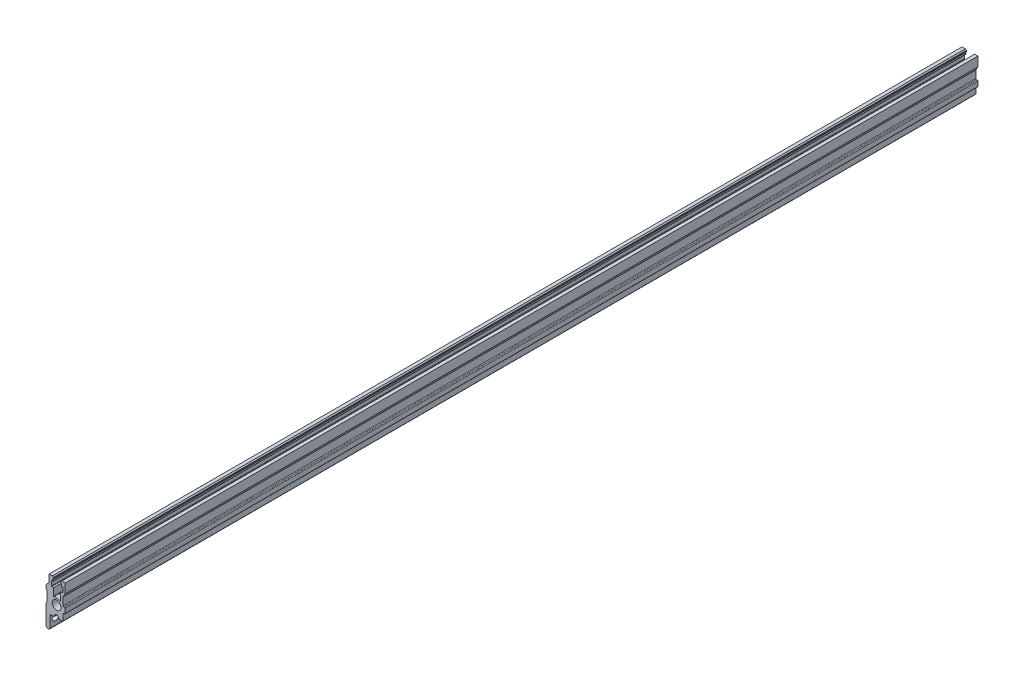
SolidWorks part; units mm, degrees
ref_plane "前视基准面" through (0, 0, 0) normal (0, 0, 1) x (1, 0, 0)
ref_plane "上视基准面" through (0, 0, 0) normal (0, 1, 0) x (1, 0, 0)
ref_plane "右视基准面" through (0, 0, 0) normal (1, 0, 0) x (0, 0, -1)
sketch "草图1" plane through (0, 0, 0) normal (0, 0, 1) x (1, 0, 0)
  line L0 (-2.3509, 8.9116) -> (-2.3509, 6.6116)
  line L1 (-2.3509, 8.9116) -> (-1.4509, 8.9116)
  line L2 (-1.4509, 8.9116) -> (-1.4509, 11.7916)
  line L3 (-1.4509, 11.7916) -> (-4.1259, 11.7916)
  line L4 (-4.1259, 11.7916) -> (-4.1259, 10.0616)
  line L5 (-4.1259, 10.0616) -> (-3.5009, 9.8916)
  line L6 (-3.5009, 9.8916) -> (-3.5009, 8.5216)
  line L7 (-3.5009, 8.5216) -> (-5.0009, 8.5216)
  line L8 (-5.0009, 8.5216) -> (-5.0009, 4.4416)
  line L9 (-5.0009, 4.4416) -> (-4.5507, 3.9414)
  line L10 (-4.5507, 3.9414) -> (-4.551, -1.0586)
  line L11 (-4.551, -1.0586) -> (-5.0009, -1.5584)
  line L12 (-5.0009, -1.5584) -> (-5.0009, -10.75)
  line L13 (-3.0009, -10.75) -> (-3.0009, -5.75)
  line L14 (2.9991, -5.05) -> (2.9991, -2.0584)
  line L15 (3.2991, -1.7584) -> (3.6991, -1.7584)
  line L16 (3.9991, -2.0584) -> (3.9991, -3.4584) construction
  line L17 (4.2991, -3.7584) -> (4.6991, -3.7584) construction
  line L18 (4.9991, -3.4584) -> (4.9991, 2.6416) construction
  line L19 (4.6991, 2.9416) -> (4.2991, 2.9416) construction
  line L20 (3.9991, 2.6416) -> (3.9991, 1.2416) construction
  line L21 (3.6991, 0.9416) -> (3.2991, 0.9416)
  line L22 (2.9991, 1.2416) -> (2.9991, 4.8054)
  line L23 (2.9991, 4.8054) -> (3.9991, 6.5374)
  line L24 (3.9991, 6.5374) -> (3.9991, 9.5216)
  line L25 (3.9991, 9.5216) -> (3.1241, 9.5216)
  line L26 (3.1241, 10.7916) -> (3.1241, 11.7916)
  line L27 (3.1241, 11.7916) -> (1.9491, 11.7916)
  line L28 (1.9491, 11.7916) -> (1.9491, 8.9116)
  line L29 (1.9491, 8.9116) -> (2.8491, 8.9116)
  line L30 (2.8491, 6.6116) -> (2.8491, 8.9116)
  line L31 (2.8491, 6.6116) -> (1.9491, 6.6116)
  line L32 (1.9491, 6.6116) -> (1.9491, 2.6797)
  line L33 (-1.4509, 2.9454) -> (-1.4509, 6.6116)
  line L34 (-1.4509, 6.6116) -> (-2.3509, 6.6116)
  line L35 (0, 0) -> (0, -5) construction
  line L36 (-1.05, -5) -> (-1.05, -5.15)
  line L37 (1.05, -5) -> (1.05, -5.15)
  line L38 (1.15, -5.25) -> (2.7991, -5.25)
  line L39 (-2.5009, -5.25) -> (-1.15, -5.25)
  line L40 (-1.4509, 10.3516) -> (1.9491, 10.3516) construction
  line L41 (-3.0009, -10.75) -> (-5.0009, -10.75) construction
  line L42 (0.2491, 10.3516) -> (0.2491, 6.8507) construction
  line L44 (3.9991, 0.6416) -> (3.9991, -1.4584)
  arc A0 (-5.0009, -10.75) -> (-3.0009, -10.75) centre (-4.0009, -10.75) ccw
  arc A1 (3.2991, -1.7584) -> (2.9991, -2.0584) centre (3.2991, -2.0584) ccw
  arc A2 (3.9991, -2.0584) -> (3.6991, -1.7584) centre (3.6991, -2.0584) ccw construction
  arc A3 (3.9991, -3.4584) -> (4.2991, -3.7584) centre (4.2991, -3.4584) ccw construction
  arc A4 (4.6991, -3.7584) -> (4.9991, -3.4584) centre (4.6991, -3.4584) ccw construction
  arc A5 (4.9991, 2.6416) -> (4.6991, 2.9416) centre (4.6991, 2.6416) ccw construction
  arc A6 (4.2991, 2.9416) -> (3.9991, 2.6416) centre (4.2991, 2.6416) ccw construction
  arc A7 (3.6991, 0.9416) -> (3.9991, 1.2416) centre (3.6991, 1.2416) ccw construction
  arc A8 (2.9991, 1.2416) -> (3.2991, 0.9416) centre (3.2991, 1.2416) ccw
  arc A9 (3.1241, 10.7916) -> (3.1241, 9.5216) centre (3.1841, 10.1566) ccw
  circle A10 centre (0, 0) radius 1.6
  arc A11 (1.6398, 2.5122) -> (-1.1727, 2.7613) centre (0, 0) ccw
  arc A12 (1.6398, 2.5122) -> (1.9491, 2.6797) centre (1.7491, 2.6797) ccw
  arc A13 (-1.4509, 2.9454) -> (-1.1727, 2.7613) centre (-1.2509, 2.9454) ccw
  arc A14 (1.05, -5) -> (-1.05, -5) centre (0, -5) ccw
  arc A15 (1.15, -5.25) -> (1.05, -5.15) centre (1.15, -5.15) cw
  arc A16 (-1.05, -5.15) -> (-1.15, -5.25) centre (-1.15, -5.15) cw
  arc A17 (3.6991, 0.9416) -> (3.9991, 0.6416) centre (3.6991, 0.6416) cw
  arc A18 (3.9991, -1.4584) -> (3.6991, -1.7584) centre (3.6991, -1.4584) cw
  arc A19 (2.7991, -5.25) -> (2.9991, -5.05) centre (2.7991, -5.05) ccw
  arc A20 (-3.0009, -5.75) -> (-2.5009, -5.25) centre (-2.5009, -5.75) cw
  point P72 (1.05, -5.25)
  dimension "D1" = 2.1
  dimension "D3" = 5
  dimension "D4" = 0.1
  dimension "D6" = 0.3
  dimension "D2" = 10.75
  dimension "D5" = 5.2
extrude "凸台-拉伸1" add sketch "草图1" along normal mid plane 431.8
sketch "草图9" plane through (0, 0, -215.9) normal (0, 0, -1) x (-1, 0, 0)
  line L0 (2.3509, 8.9116) -> (1.4509, 8.9116) construction
  line L1 (2.4509, 8.9116) -> (-2.9491, 8.9116)
  line L2 (2.4509, 8.9116) -> (2.4509, 6.4116)
  line L3 (2.4509, 6.4116) -> (-2.9491, 6.4116)
  line L4 (-2.9491, 8.9116) -> (-2.9491, 6.4116)
  line L5 (2.3509, 6.6116) -> (2.3509, 8.9116) construction
  line L6 (-2.8491, 8.9116) -> (-2.8491, 6.6116) construction
  line L7 (-2.8491, 6.6116) -> (-1.9491, 6.6116) construction
  dimension "D1" = 0.1
  dimension "D2" = 0.1
  dimension "D3" = 0.2
extrude "切除-拉伸7" cut sketch "草图9" against normal through all
fillet "圆角4" radius 0.2 4 edges at (-2.4509, 8.9116, 0) (-2.4509, 6.4116, 0) (2.9491, 8.9116, 0) (2.9491, 6.4116, 0)
sketch "草图2" plane through (0, 0, -215.9) normal (0, 0, -1) x (-1, 0, 0)
  circle A0 centre (0, 0) radius 2.1
  dimension "D1" = 4.2
extrude "切除-拉伸1" cut sketch "草图2" against normal blind 10
sketch "草图3" plane through (0, 0, 215.9) normal (0, 0, 1) x (1, 0, 0)
  circle A0 centre (0, 0) radius 2.1
  dimension "D1" = 4.2
extrude "切除-拉伸2" cut sketch "草图3" against normal blind 10
sketch "草图4" plane through (-5.0009, 0, 0) normal (-1, 0, 0) x (0, 0, 1)
  line L0 (-215.9, -1.5584) -> (-215.9, -10.75) construction
  line L1 (-215.9, -11.75) -> (215.9, -11.75) construction
  circle A0 centre (-213.36, -7.5) radius 1.65
  circle A1 centre (-208.28, -7.5) radius 1.65
  circle A2 centre (-203.2, -7.5) radius 1.65
  circle A3 centre (-198.12, -7.5) radius 1.65
  circle A4 centre (-193.04, -7.5) radius 1.65
  circle A5 centre (-187.96, -7.5) radius 1.65
  circle A6 centre (-182.88, -7.5) radius 1.65
  circle A7 centre (-177.8, -7.5) radius 1.65
  circle A8 centre (-172.72, -7.5) radius 1.65
  circle A9 centre (-167.64, -7.5) radius 1.65
  circle A10 centre (-162.56, -7.5) radius 1.65
  circle A11 centre (-157.48, -7.5) radius 1.65
  circle A12 centre (-152.4, -7.5) radius 1.65
  circle A13 centre (-147.32, -7.5) radius 1.65
  circle A14 centre (-142.24, -7.5) radius 1.65
  circle A15 centre (-137.16, -7.5) radius 1.65
  circle A16 centre (-132.08, -7.5) radius 1.65
  circle A17 centre (-127, -7.5) radius 1.65
  circle A18 centre (-121.92, -7.5) radius 1.65
  circle A19 centre (-116.84, -7.5) radius 1.65
  circle A20 centre (-111.76, -7.5) radius 1.65
  circle A21 centre (-106.68, -7.5) radius 1.65
  circle A22 centre (-101.6, -7.5) radius 1.65
  circle A23 centre (-96.52, -7.5) radius 1.65
  circle A24 centre (-91.44, -7.5) radius 1.65
  circle A25 centre (-86.36, -7.5) radius 1.65
  circle A26 centre (-81.28, -7.5) radius 1.65
  circle A27 centre (-76.2, -7.5) radius 1.65
  circle A28 centre (-71.12, -7.5) radius 1.65
  circle A29 centre (-66.04, -7.5) radius 1.65
  circle A30 centre (-60.96, -7.5) radius 1.65
  circle A31 centre (-55.88, -7.5) radius 1.65
  circle A32 centre (-50.8, -7.5) radius 1.65
  circle A33 centre (-45.72, -7.5) radius 1.65
  circle A34 centre (-40.64, -7.5) radius 1.65
  circle A35 centre (-35.56, -7.5) radius 1.65
  circle A36 centre (-30.48, -7.5) radius 1.65
  circle A37 centre (-25.4, -7.5) radius 1.65
  circle A38 centre (-20.32, -7.5) radius 1.65
  circle A39 centre (-15.24, -7.5) radius 1.65
  circle A40 centre (-10.16, -7.5) radius 1.65
  circle A41 centre (-5.08, -7.5) radius 1.65
  circle A42 centre (0, -7.5) radius 1.65
  circle A43 centre (5.08, -7.5) radius 1.65
  circle A44 centre (10.16, -7.5) radius 1.65
  circle A45 centre (15.24, -7.5) radius 1.65
  circle A46 centre (20.32, -7.5) radius 1.65
  circle A47 centre (25.4, -7.5) radius 1.65
  circle A48 centre (30.48, -7.5) radius 1.65
  circle A49 centre (35.56, -7.5) radius 1.65
  circle A50 centre (40.64, -7.5) radius 1.65
  circle A51 centre (45.72, -7.5) radius 1.65
  circle A52 centre (50.8, -7.5) radius 1.65
  circle A53 centre (55.88, -7.5) radius 1.65
  circle A54 centre (60.96, -7.5) radius 1.65
  circle A55 centre (66.04, -7.5) radius 1.65
  circle A56 centre (71.12, -7.5) radius 1.65
  circle A57 centre (76.2, -7.5) radius 1.65
  circle A58 centre (81.28, -7.5) radius 1.65
  circle A59 centre (86.36, -7.5) radius 1.65
  circle A60 centre (91.44, -7.5) radius 1.65
  circle A61 centre (96.52, -7.5) radius 1.65
  circle A62 centre (101.6, -7.5) radius 1.65
  circle A63 centre (106.68, -7.5) radius 1.65
  circle A64 centre (111.76, -7.5) radius 1.65
  circle A65 centre (116.84, -7.5) radius 1.65
  circle A66 centre (121.92, -7.5) radius 1.65
  circle A67 centre (127, -7.5) radius 1.65
  circle A68 centre (132.08, -7.5) radius 1.65
  circle A69 centre (137.16, -7.5) radius 1.65
  circle A70 centre (142.24, -7.5) radius 1.65
  circle A71 centre (147.32, -7.5) radius 1.65
  circle A72 centre (152.4, -7.5) radius 1.65
  circle A73 centre (157.48, -7.5) radius 1.65
  circle A74 centre (162.56, -7.5) radius 1.65
  circle A75 centre (167.64, -7.5) radius 1.65
  circle A76 centre (172.72, -7.5) radius 1.65
  circle A77 centre (177.8, -7.5) radius 1.65
  circle A78 centre (182.88, -7.5) radius 1.65
  circle A79 centre (187.96, -7.5) radius 1.65
  circle A80 centre (193.04, -7.5) radius 1.65
  circle A81 centre (198.12, -7.5) radius 1.65
  circle A82 centre (203.2, -7.5) radius 1.65
  circle A83 centre (208.28, -7.5) radius 1.65
  circle A84 centre (213.36, -7.5) radius 1.65
  dimension "D1" = 3.3
  dimension "D5" = 5.08
  dimension "D2" = 2.54
  dimension "D3" = 4.25
  dimension "D4" = 85
extrude "切除-拉伸3" cut sketch "草图4" against normal blind 12
sketch "草图5" plane through (0, 0, 215.9) normal (0, 0, 1) x (1, 0, 0)
  line L0 (1.9491, 8.9116) -> (2.7491, 8.9116) construction
  line L1 (1.9491, 8.9116) -> (3.9991, 8.9116)
  line L2 (1.9491, 8.9116) -> (1.9491, 11.7916)
  line L3 (1.9491, 11.7916) -> (3.9991, 11.7916)
  line L4 (3.9991, 8.9116) -> (3.9991, 11.7916)
  line L5 (3.1241, 11.7916) -> (1.9491, 11.7916) construction
  line L6 (3.9991, 6.5374) -> (3.9991, 9.5216) construction
  line L7 (-1.4509, 11.7916) -> (-4.1259, 11.7916) construction
  line L8 (-5.0009, 8.5216) -> (-2.7884, 8.5216)
  line L9 (-5.0009, 8.5216) -> (-5.0009, 11.7916)
  line L10 (-5.0009, 11.7916) -> (-2.7884, 11.7916)
  line L11 (-2.7884, 8.5216) -> (-2.7884, 11.7916)
extrude "凸台-拉伸2" add sketch "草图5" against normal up to surface (431.8 mm away)
sketch "草图6" plane through (0, 0, -215.9) normal (0, 0, -1) x (-1, 0, 0)
  line L0 (-1.9491, 9.4916) -> (1.4509, 9.4916) construction
  line L1 (-1.9491, 11.7916) -> (-1.9491, 8.9116) construction
  line L2 (1.4509, 8.9116) -> (1.4509, 11.7916) construction
  line L3 (1.4509, 11.7916) -> (5.0009, 11.7916) construction
  line L4 (-2.3491, 8.9916) -> (1.8509, 8.9916)
  line L5 (-2.3491, 8.9916) -> (-2.3491, 9.9916)
  line L6 (-2.3491, 9.9916) -> (1.8509, 9.9916)
  line L7 (1.8509, 8.9916) -> (1.8509, 9.9916)
  line L8 (-2.3491, 8.9916) -> (1.8509, 9.9916) construction
  line L9 (-2.3491, 9.9916) -> (1.8509, 8.9916) construction
  point P6 (-0.2491, 9.4916)
  dimension "D1" = 1
  dimension "D2" = 4.2
  dimension "D3" = 1.8
extrude "切除-拉伸4" cut sketch "草图6" against normal through all
sketch "草图8" plane through (0, 0, -215.9) normal (0, 0, -1) x (-1, 0, 0)
  line L0 (5.0009, 11.7916) -> (5.0009, 4.4416) construction
  line L1 (-3.9991, 11.7916) -> (5.0009, 11.7916)
  line L2 (-3.9991, 11.7916) -> (-3.9991, 11.0016)
  line L3 (-3.9991, 11.0016) -> (5.0009, 11.0016)
  line L4 (5.0009, 11.7916) -> (5.0009, 11.0016)
  dimension "D1" = 0.79
extrude "切除-拉伸6" cut sketch "草图8" against normal through all
fillet "圆角1" radius 0.5 4 edges at (-1.8509, 9.9916, 0) (-1.8509, 8.9916, 0) (2.3491, 9.9916, 0) (2.3491, 8.9916, 0)
chamfer "倒角1" distance 0.5 angle 45 2 edges at (-1.4509, 11.0016, 0) (1.9491, 11.0016, 0)
fillet "圆角2" radius 0.2 6 edges at (1.9491, 10.5016, 0) (-1.4509, 10.5016, 0) (-1.4509, 8.9916, 0) (-1.4509, 9.9916, 0) (1.9491, 8.9916, 0) (1.9491, 9.9916, 0)
fillet "圆角3" radius 0.1 2 edges at (-1.4509, 8.9116, 0) (1.9491, 8.9116, 0)
sketch "草图7" plane through (0, 0, -215.9) normal (0, 0, -1) x (-1, 0, 0)
  line L0 (5.0009, 11.0016) -> (3.5009, 11.0016)
  line L2 (3.5009, 11.0016) -> (3.5009, 7.4416)
  line L3 (3.5009, 7.4416) -> (5.0009, 5.9416)
  line L4 (5.0009, 11.0016) -> (5.0009, 4.4416) construction
  line L5 (5.0009, 5.9416) -> (5.0009, 11.0016)
  line L6 (1.4509, 10.1341) -> (1.4509, 10.4187) construction
  line L7 (1.9509, 11.0016) -> (5.0009, 11.0016) construction
  dimension "D1" = 2.05
  dimension "D2" = 1.5
  dimension "D3" = 45
extrude "切除-拉伸5" cut sketch "草图7" against normal through all
